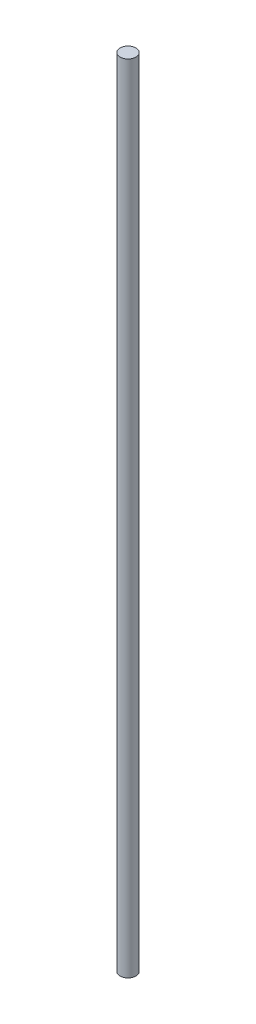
SolidWorks part; units mm, degrees
ref_plane "前视基准面" through (0, 0, 0) normal (0, 0, 1) x (1, 0, 0)
ref_plane "上视基准面" through (0, 0, 0) normal (0, 1, 0) x (1, 0, 0)
ref_plane "右视基准面" through (0, 0, 0) normal (1, 0, 0) x (0, 0, -1)
sketch "草图1" plane through (0, 0, 0) normal (0, 1, 0) x (1, 0, 0)
  circle A0 centre (0, 0) radius 2.5
  dimension "D1" = 5
extrude "凸台-拉伸1" add sketch "草图1" along normal blind 250
